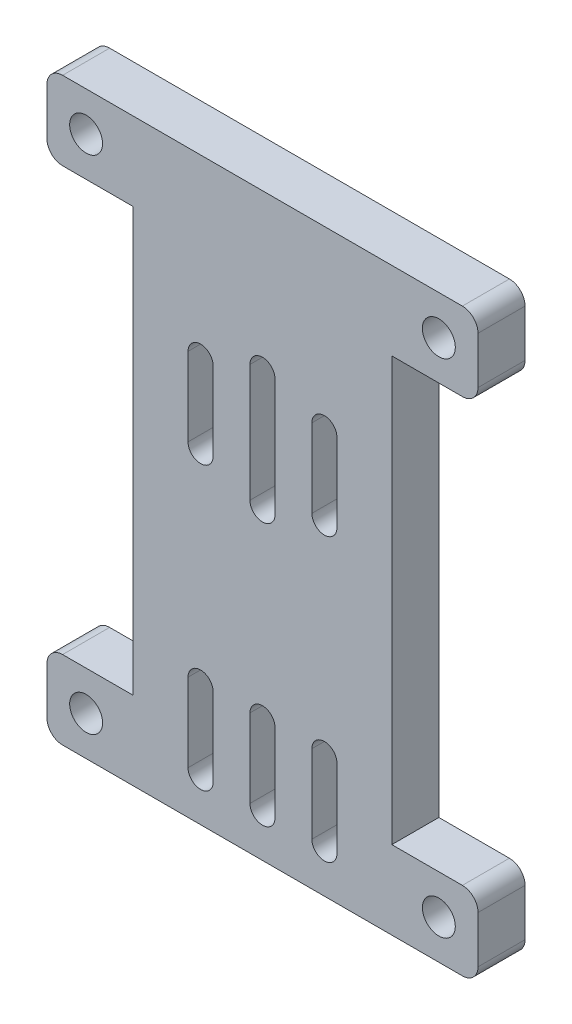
SolidWorks part; units mm, degrees
ref_plane "Спереди" through (0, 0, 0) normal (0, 0, 1) x (1, 0, 0)
ref_plane "Сверху" through (0, 0, 0) normal (0, 1, 0) x (1, 0, 0)
ref_plane "Справа" through (0, 0, 0) normal (1, 0, 0) x (0, 0, -1)
sketch "Эскиз1" plane through (0, 0, 0) normal (0, 0, 1) x (1, 0, 0)
  line L0 (16.5, 0) -> (16.5, -14.4129) construction
  line L1 (0, 0) -> (33, 0)
  line L2 (0, 0) -> (0, 69)
  line L3 (0, 69) -> (33, 69)
  line L4 (33, 0) -> (33, 69)
  line L5 (8.6, 49) -> (8.6, 39) construction
  line L6 (10.2, 49) -> (10.2, 39)
  line L7 (7, 49) -> (7, 39)
  line L8 (16.5, 51.5) -> (16.5, 36.5) construction
  line L9 (18.1, 51.5) -> (18.1, 36.5)
  line L10 (14.9, 51.5) -> (14.9, 36.5)
  line L11 (24.4, 49) -> (24.4, 39) construction
  line L12 (26, 49) -> (26, 39)
  line L13 (22.8, 49) -> (22.8, 39)
  line L14 (16.5, 13) -> (16.5, 3) construction
  line L15 (18.1, 13) -> (18.1, 3)
  line L16 (14.9, 13) -> (14.9, 3)
  line L17 (8.6, 13) -> (8.6, 3) construction
  line L18 (10.2, 13) -> (10.2, 3)
  line L19 (7, 13) -> (7, 3)
  line L20 (24.4, 13) -> (24.4, 3) construction
  line L21 (26, 13) -> (26, 3)
  line L22 (22.8, 13) -> (22.8, 3)
  arc A0 (10.2, 49) -> (7, 49) centre (8.6, 49) ccw
  arc A1 (7, 39) -> (10.2, 39) centre (8.6, 39) ccw
  arc A2 (18.1, 51.5) -> (14.9, 51.5) centre (16.5, 51.5) ccw
  arc A3 (14.9, 36.5) -> (18.1, 36.5) centre (16.5, 36.5) ccw
  arc A4 (26, 49) -> (22.8, 49) centre (24.4, 49) ccw
  arc A5 (22.8, 39) -> (26, 39) centre (24.4, 39) ccw
  arc A6 (18.1, 13) -> (14.9, 13) centre (16.5, 13) ccw
  arc A7 (14.9, 3) -> (18.1, 3) centre (16.5, 3) ccw
  arc A8 (10.2, 13) -> (7, 13) centre (8.6, 13) ccw
  arc A9 (7, 3) -> (10.2, 3) centre (8.6, 3) ccw
  arc A10 (26, 13) -> (22.8, 13) centre (24.4, 13) ccw
  arc A11 (22.8, 3) -> (26, 3) centre (24.4, 3) ccw
  point P7 (8.6, 44)
  point P12 (16.5, 44)
  point P21 (24.4, 44)
  point P28 (16.5, 8)
  point P35 (8.6, 8)
  point P42 (24.4, 8)
extrude "Бобышка-Вытянуть1" add sketch "Эскиз1" along normal blind 6
sketch "Эскиз2" plane through (0, 0, 6) normal (0, 0, 1) x (1, 0, 0)
  line L0 (33, 69) -> (0, 69) construction
  line L1 (-6, 66.5) -> (39, 66.5) construction
  line L2 (-6, 66.5) -> (-6, 2.5) construction
  line L3 (-6, 2.5) -> (39, 2.5) construction
  line L4 (39, 66.5) -> (39, 2.5) construction
  line L5 (0, 69) -> (0, 0) construction
  line L7 (-9, 71.5) -> (42, 71.5)
  line L8 (-11, 69.5) -> (-11, 63.5)
  line L9 (-9, 61.5) -> (42, 61.5)
  line L10 (44, 69.5) -> (44, 63.5)
  line L11 (-9, 7.5) -> (42, 7.5)
  line L12 (-11, 5.5) -> (-11, -0.5)
  line L13 (-9, -2.5) -> (42, -2.5)
  line L14 (44, 5.5) -> (44, -0.5)
  line L15 (0, 69) -> (33, 69)
  line L16 (0, 69) -> (0, 0)
  line L17 (0, 0) -> (33, 0)
  line L18 (33, 69) -> (33, 0)
  circle A0 centre (-6, 66.5) radius 2.1
  circle A1 centre (39, 66.5) radius 2.1
  circle A2 centre (-6, 2.5) radius 2.1
  circle A3 centre (39, 2.5) radius 2.1
  arc A4 (-11, 63.5) -> (-9, 61.5) centre (-9, 63.5) ccw
  arc A5 (-9, 71.5) -> (-11, 69.5) centre (-9, 69.5) ccw
  arc A6 (42, 71.5) -> (44, 69.5) centre (42, 69.5) cw
  arc A7 (42, 61.5) -> (44, 63.5) centre (42, 63.5) ccw
  arc A8 (42, 7.5) -> (44, 5.5) centre (42, 5.5) cw
  arc A9 (42, -2.5) -> (44, -0.5) centre (42, -0.5) ccw
  arc A10 (-11, -0.5) -> (-9, -2.5) centre (-9, -0.5) ccw
  arc A11 (-9, 7.5) -> (-11, 5.5) centre (-9, 5.5) ccw
  point P4 (16.5, 66.5)
  point P5 (-6, 34.5)
  point P6 (16.5, 69)
  point P7 (0, 34.5)
  dimension "D3" = 4.2
  dimension "D12" = 2
  dimension "D1" = 45
  dimension "D2" = 64
  dimension "D4" = 5
  dimension "D5" = 5
  dimension "D6" = 5
  dimension "D7" = 5
  dimension "D8" = 5
  dimension "D9" = 5
  dimension "D10" = 5
  dimension "D11" = 5
extrude "Бобышка-Вытянуть2" add sketch "Эскиз2" against normal up to surface (6 mm away) contours L9 A7 L10 A6 L7 A5 L8 A4 A0 A1 M23 M26 M25 | L11 A11 L12 A10 L13 A9 L14 A8 A2 A3 M25 M24 M23
equation "\"D16@Эскиз1\"=\"D9@Эскиз1\"/2"
